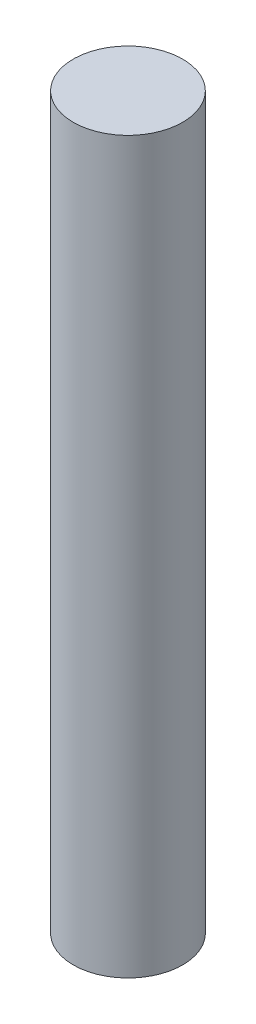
SolidWorks part; units mm, degrees
ref_plane "前视基准面" through (0, 0, 0) normal (0, 0, 1) x (1, 0, 0)
ref_plane "上视基准面" through (0, 0, 0) normal (0, 1, 0) x (1, 0, 0)
ref_plane "右视基准面" through (0, 0, 0) normal (1, 0, 0) x (0, 0, -1)
sketch "草图1" plane through (0, 0, 0) normal (0, 1, 0) x (1, 0, 0)
  circle A0 centre (-0.6894, 0.4062) radius 1.5
  dimension "D1" = 3
extrude "凸台-拉伸1" add sketch "草图1" along normal blind 20
